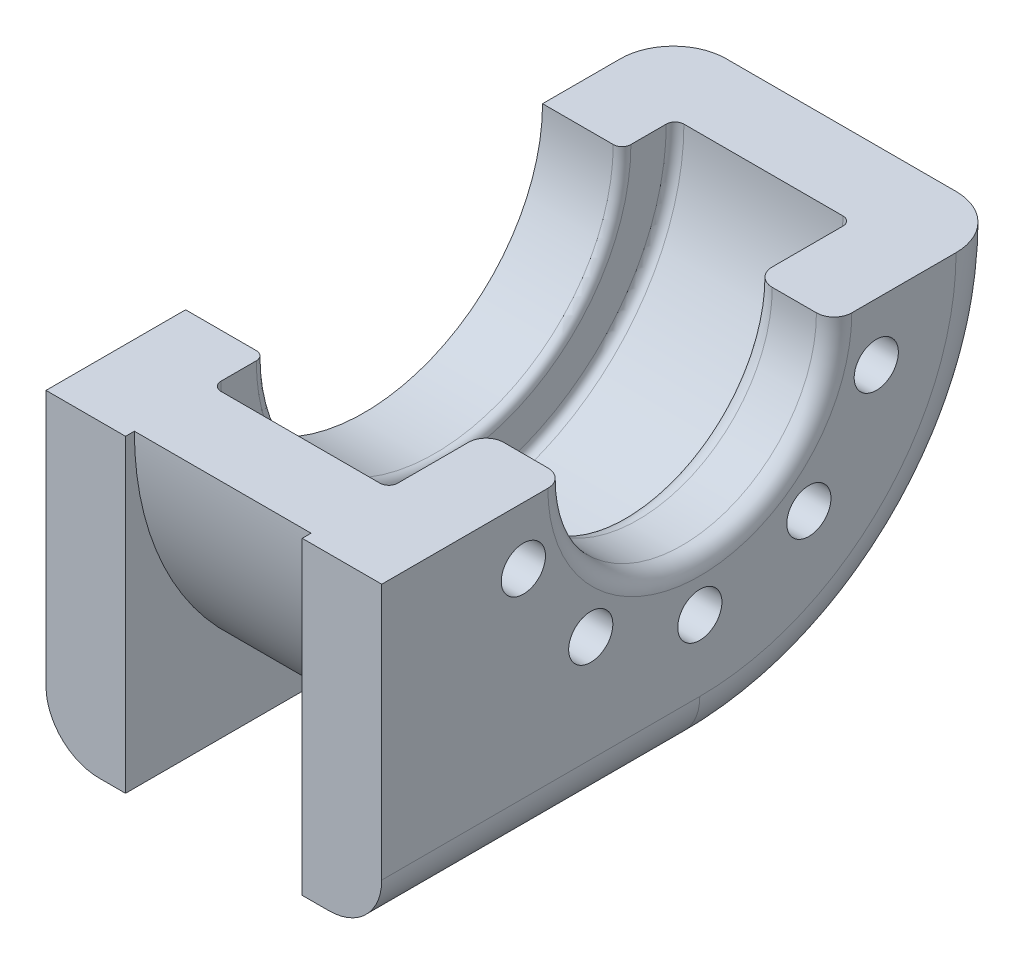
SolidWorks part; units mm, degrees
ref_plane "Front Plane" through (0, 0, 0) normal (0, 0, 1) x (1, 0, 0)
ref_plane "Top Plane" through (0, 0, 0) normal (0, 1, 0) x (1, 0, 0)
ref_plane "Right Plane" through (0, 0, 0) normal (1, 0, 0) x (0, 0, -1)
sketch "Schizzo1" plane through (0, 0, 0) normal (1, 0, 0) x (0, 0, -1)
  line L0 (0, -175) -> (0, 175) construction
  line L1 (-180, 174.9997) -> (-180, -175)
  line L2 (-180, -175) -> (0, -175)
  line L3 (-180, 174.9997) -> (0, 175)
  line L4 (-180, -0.0001) -> (175, 0) construction
  arc A1 (0, -175) -> (0, 175) centre (0, 0) ccw
  dimension "D1" = 175
  dimension "D2" = 180
extrude "Estrusione-Estrusione2" add sketch "Schizzo1" against normal blind 190
sketch "Schizzo3" plane through (0, 0, 0) normal (1, 0, 0) x (0, 0, -1)
  circle A0 centre (0, 0) radius 76
  dimension "D1" = 152
extrude "Taglio-Estrusione1" cut sketch "Schizzo3" against normal through all
sketch "Schizzo4" plane through (-190, 0, 0) normal (-1, 0, 0) x (0, 0, 1)
  circle A0 centre (0, 0) radius 101
  dimension "D1" = 202
extrude "Taglio-Estrusione2" cut sketch "Schizzo4" against normal blind 45
sketch "Schizzo5" plane through (-145, 0, 0) normal (-1, 0, 0) x (0, 0, 1)
  circle A0 centre (0, 0) radius 131
  dimension "D1" = 262
extrude "Taglio-Estrusione3" cut sketch "Schizzo5" against normal blind 100
sketch "Schizzo6" plane through (0, 0, 0) normal (1, 0, 0) x (0, 0, -1)
  line L0 (0, 0) -> (-105, 0) construction
  line L2 (-99.8609, -32.4468) -> (72.2803, 23.4853) construction
  circle A0 centre (0, 0) radius 105 construction
  circle A1 centre (0, 0) radius 76 construction
  point P37 (0, 0)
  dimension "D1" = 210
  dimension "D2" = 18
hole_wizard "Ø25.0mm Dowel Hole1" positions "Schizzo3D1" profile "Schizzo8" hole size "Ø25.0" standard "ISO"
sketch3d "Schizzo3D1"
  point P0 (0, -32.4468, 99.8609)
sketch "Schizzo8" plane through (0, -32.4468, 99.8609) normal (0, 1, 0) x (0, 0, -1)
  line L0 (0, 0) -> (0, 52.5108)
  line L1 (0, 52.5108) -> (12.5, 45)
  line L2 (12.5, 45) -> (12.5, 0)
  line L5 (12.5, 0) -> (0, 0)
  line L10 (0, 52.5108) -> (-12.5, 45) construction
  line L11 (0, -6.35) -> (0, 107.95) construction
  dimension "Hole Dia." = 25
  dimension "Hole Depth" = 45
  dimension "Drill Angle" = 118
sketch "Schizzo10" plane through (0, 0, 0) normal (1, 0, 0) x (0, 0, -1)
  line L0 (175, 0) -> (-180, -0.0001)
  line L2 (-180, 174.9997) -> (-180, -175) construction
  line L3 (-180, -0.0001) -> (-180, 174.9997)
  line L4 (-180, 174.9997) -> (175, 174.9997)
  line L5 (175, 174.9997) -> (175, 0)
  arc A1 (0, -175) -> (0, 175) centre (0, 0) ccw construction
extrude "Taglio-Estrusione4" cut sketch "Schizzo10" against normal through all
fillet "Raccordo1" radius 5 1 edges at (-145, -101, 0)
sketch "Schizzo11" plane through (0, 0, 0) normal (0, 1, 0) x (1, 0, 0)
  line L0 (0, 0) -> (-137.8055, 0) construction
pattern_circular "RipetizioneCircolare1" count 10 over 360 about axis through (0, 0, 0) along (1, 0, 0) of "Ø25.0mm Dowel Hole1"
ref_plane "Piano1" through (10, 0, 0) normal (1, 0, 0) x (0, 0, -1)
fillet "Raccordo3" radius 30 4 edges at (-190, -175, 90) (0, -175, 90) (-190, -123.7437, -123.7437) (0, -123.7437, -123.7437)
ref_plane "Piano2" through (-145, 0, 0) normal (-1, 0, 0) x (0, 0, 1)
sketch "Schizzo15" plane through (0, 0, 180) normal (0, 0, 1) x (1, 0, 0)
  line L0 (0, 0) -> (-137.8055, 0) construction
  line L1 (0, -105) -> (0, 105) construction
  line L2 (-190, -0.0001) -> (-190, -145) construction
  point P4 (-20, -40)
  point P5 (-170, -40)
  dimension "D1" = 40
  dimension "D2" = 40
  dimension "D3" = 20
  dimension "D4" = 20
hole_wizard "Foro filettato M10-2" positions "Schizzo3D3" profile "Schizzo16" tap size "M10" standard "ISO"
sketch3d "Schizzo3D3"
  point P0 (-20, -40, 180)
  point P3 (-170, -40, 180)
sketch "Schizzo16" plane through (-20, -40, 180) normal (1, 0, 0) x (0, -1, 0)
  line L0 (0, 0) -> (0, 27.5537)
  line L1 (0, 27.5537) -> (4.25, 25)
  line L2 (4.25, 25) -> (4.25, 0)
  line L5 (4.25, 0) -> (0, 0)
  line L10 (0, 27.5537) -> (-4.25, 25) construction
  line L11 (0, -6.35) -> (0, 107.95) construction
  dimension "Tap Drill Dia." = 8.5
  dimension "Tap Drill Depth" = 25
  dimension "Drill Angle" = 118
sketch "Schizzo17" plane through (0, 0, 180) normal (0, 0, 1) x (1, 0, 0)
  line L0 (0, 0) -> (-137.8055, 0) construction
  line L1 (0, -0.0001) -> (0, -145) construction
  line L2 (-190, -0.0001) -> (-190, -145) construction
  point P0 (-20, -80)
  point P1 (-170, -80)
  dimension "D1" = 80
  dimension "D2" = 20
  dimension "D3" = 20
  dimension "D4" = 80
hole_wizard "Foro filettato M10-3" positions "Schizzo3D4" profile "Schizzo18" tap size "M10" standard "ISO"
sketch3d "Schizzo3D4"
  point P0 (-20, -80, 180)
  point P3 (-170, -80, 180)
sketch "Schizzo18" plane through (-20, -80, 180) normal (1, 0, 0) x (0, -1, 0)
  line L0 (0, 0) -> (0, 37.5537)
  line L1 (0, 37.5537) -> (4.25, 35)
  line L2 (4.25, 35) -> (4.25, 0)
  line L5 (4.25, 0) -> (0, 0)
  line L10 (0, 37.5537) -> (-4.25, 35) construction
  line L11 (0, -6.35) -> (0, 107.95) construction
  dimension "Tap Drill Dia." = 8.5
  dimension "Tap Drill Depth" = 35
  dimension "Drill Angle" = 118
sketch "Schizzo20" plane through (0, 0, 180) normal (0, 0, 1) x (1, 0, 0)
  line L0 (0, -0.0001) -> (0, -145) construction
  line L1 (0, 0) -> (-137.8055, 0) construction
  line L3 (-190, -0.0001) -> (-190, -145) construction
  point P0 (-20, -120)
  point P1 (-170, -120)
  dimension "D1" = 20
  dimension "D2" = 120
  dimension "D3" = 20
  dimension "D4" = 120
fillet "Raccordo4" radius 10 1 edges at (-45, -76, 0)
fillet "Raccordo5" radius 5 2 edges at (-145, -131, 0) (-45, -131, 0)
hole_wizard "Foro filettato M10-4" positions "Schizzo3D5" profile "Schizzo23" tap size "M10" standard "ISO"
sketch3d "Schizzo3D5"
  point P0 (-170, -120, 180)
  point P3 (-20, -120, 180)
sketch "Schizzo23" plane through (-170, -120, 180) normal (1, 0, 0) x (0, -1, 0)
  line L0 (0, 0) -> (0, 47.5537)
  line L1 (0, 47.5537) -> (4.25, 45)
  line L2 (4.25, 45) -> (4.25, 0)
  line L5 (4.25, 0) -> (0, 0)
  line L10 (0, 47.5537) -> (-4.25, 45) construction
  line L11 (0, -6.35) -> (0, 107.95) construction
  dimension "Tap Drill Dia." = 8.5
  dimension "Tap Drill Depth" = 45
  dimension "Drill Angle" = 118
sketch "Schizzo24" plane through (-145, 0, 0) normal (1, 0, 0) x (0, 0, -1)
  line L0 (-180, -0.0001) -> (-76, -0.0001) construction
  line L1 (-180, -0.0001) -> (-180, -145) construction
  line L2 (-180, -145) -> (-180, -175) construction
  line L3 (0, -175) -> (-180, -175) construction
  line L4 (-180, -0.0001) -> (-175, -0.0001)
  line L5 (-180, -0.0001) -> (-180, -145)
  line L6 (-180, -145) -> (-180, -175)
  line L7 (0, -175) -> (-180, -175)
  arc A0 (-175, -0.0001) -> (0, -175) centre (0, 0) ccw
extrude "Taglio-Estrusione5" cut sketch "Schizzo24" along normal blind 100
fillet "Raccordo6" radius 10 1 edges at (0, -76, 0)
sketch "Schizzo25" plane through (0, 0, 0) normal (1, 0, 0) x (0, 0, -1)
  line L0 (-280, 0) -> (0, 0) construction
  dimension "D1" = 280
